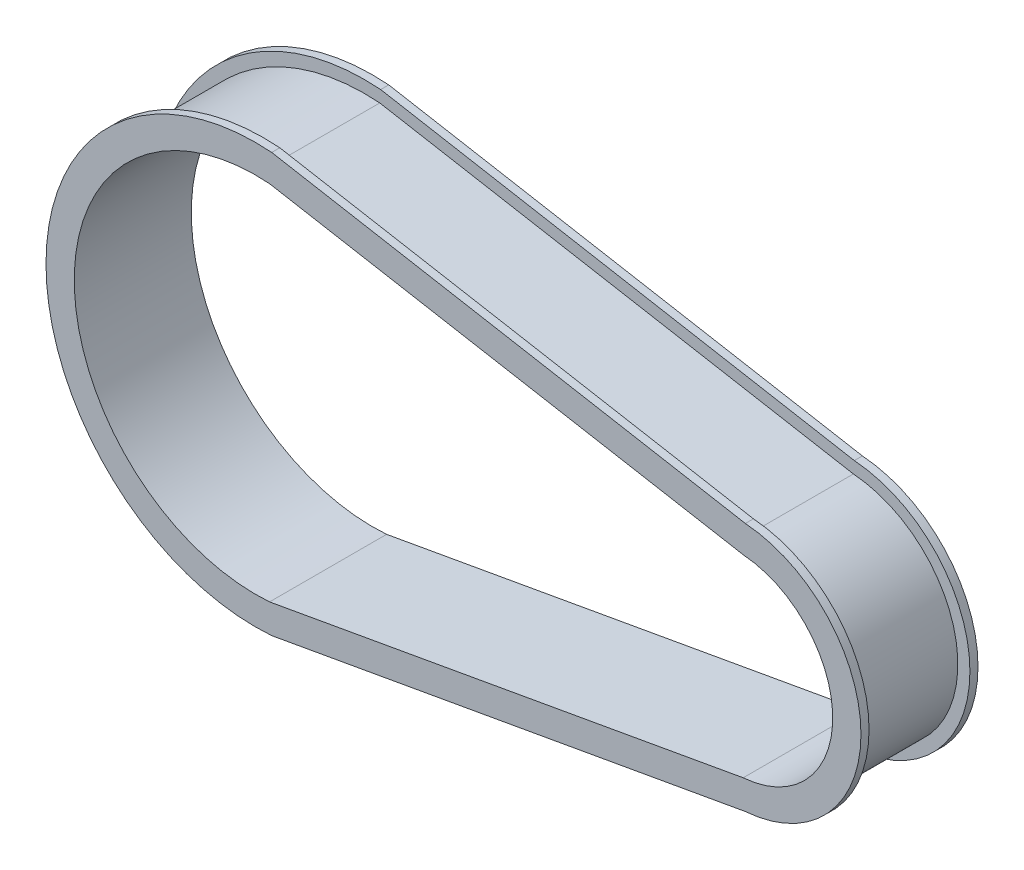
SolidWorks part; units mm, degrees
ref_plane "Front" through (0, 0, 0) normal (0, 0, 1) x (1, 0, 0)
ref_plane "Top" through (0, 0, 0) normal (0, 1, 0) x (1, 0, 0)
ref_plane "Right" through (0, 0, 0) normal (1, 0, 0) x (0, 0, -1)
sketch "Sketch1" plane through (0, 0, 0) normal (0, 0, 1) x (1, 0, 0)
  line L0 (0.9268, -12.2149) -> (30.2696, -6.9799)
  line L3 (0.9268, 12.2149) -> (30.2696, 6.9799)
  line L4 (0.8511, -11.2178) -> (30.1939, -5.9828)
  line L5 (0.8511, 11.2178) -> (30.1939, 5.9828)
  arc A2 (0.9268, 12.2149) -> (0.9268, -12.2149) centre (0, 0) ccw
  arc A3 (30.2696, -6.9799) -> (30.2696, 6.9799) centre (29.74, 0) ccw
  arc A4 (0.8511, 11.2178) -> (0.8511, -11.2178) centre (0, 0) ccw
  arc A5 (30.1939, -5.9828) -> (30.1939, 5.9828) centre (29.74, 0) ccw
  dimension "D1" = 29.74
  dimension "D2" = 11.25
  dimension "D3" = 6
  dimension "D4" = 7
  dimension "D5" = 12.25
extrude "Extrude1" add sketch "Sketch1" along normal blind 6.25
sketch "Sketch3" plane through (0, 0, 6.25) normal (0, 0, 1) x (1, 0, 0)
  line L1 (0.9835, 12.9627) -> (30.3263, 7.7278)
  line L3 (0.9835, -12.9627) -> (30.3263, -7.7278)
  line L4 (0.8511, 11.2178) -> (30.1939, 5.9828)
  line L5 (0.8511, -11.2178) -> (30.1939, -5.9828)
  arc A2 (30.3263, -7.7278) -> (30.3263, 7.7278) centre (29.74, 0) ccw
  arc A3 (0.9835, 12.9627) -> (0.9835, -12.9627) centre (0, 0) ccw
  arc A4 (30.1939, -5.9828) -> (30.1939, 5.9828) centre (29.74, 0) ccw
  arc A5 (0.8511, 11.2178) -> (0.8511, -11.2178) centre (0, 0) ccw
  dimension "D2" = 7.75
  dimension "D3" = 6
  dimension "D4" = 11.25
  dimension "D5" = 13
  dimension "D1" = 29.74
extrude "Extrude2" add sketch "Sketch3" along normal blind 0.5
ref_plane "Plane1" through (0, 0, 3.125) normal (0, 0, 1) x (1, 0, 0)
mirror "Mirror2" about plane through (0, 0, 3.125) normal (0, 0, 1) of "Extrude2"
